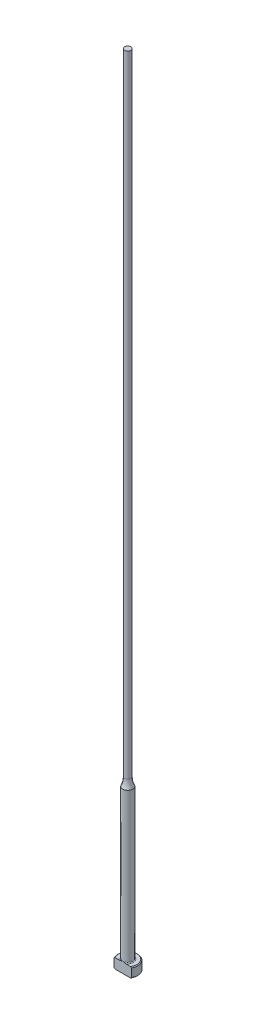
SolidWorks part; units mm, degrees
ref_plane "Front Plane" through (0, 0, 0) normal (0, 0, 1) x (1, 0, 0)
ref_plane "Top Plane" through (0, 0, 0) normal (0, 1, 0) x (1, 0, 0)
ref_plane "Right Plane" through (0, 0, 0) normal (1, 0, 0) x (0, 0, -1)
sketch "Sketch1" plane through (0, 0, 0) normal (0, 0, 1) x (1, 0, 0)
  line L0 (0, 259.9588) -> (0, -15.1925) construction
  line L1 (0, 0) -> (-3.175, 0)
  line L2 (-3.175, 0) -> (-3.175, 3.175)
  line L3 (-3.175, 3.175) -> (-1.5875, 3.175)
  line L4 (-0.9919, 53.4851) -> (-0.9919, 254)
  line L5 (-0.9919, 254) -> (0, 254)
  line L6 (0, 254) -> (0, 0)
  line L7 (-1.5875, 3.175) -> (-1.5875, 50.8)
  arc A0 (-1.5875, 50.8) -> (-0.9919, 53.4851) centre (-7.3419, 53.4851) ccw
  point P13 (-1.5875, 0)
  dimension "D1" = 6.35
  dimension "L" = 254
  dimension "D2" = 3.175
  dimension "H" = 6.35
  dimension "T" = 3.175
  dimension "D" = 1.9837
  dimension "S" = 50.8
revolve "Revolve1" add sketch "Sketch1" angle 360 about L0
chamfer "Chamfer1" distance 0.254 angle 45 2 edges at (0, 3.175, 3.175) (0, 0, 3.175)
fillet "Fillet1" radius 0.254 1 edges at (0, 3.175, 1.5875)
sketch "Sketch2" plane through (0, 0, 0) normal (0, -1, 0) x (1, 0, 0)
  line L0 (-2.7496, 1.5875) -> (2.7496, 1.5875)
  circle A0 centre (0, 0) radius 3.175 construction
  arc A1 (2.7496, 1.5875) -> (-2.7496, 1.5875) centre (0, 0) ccw
  circle A4 centre (0, 0) radius 1.5875 construction
  dimension "D1" = 0
extrude "KEY" cut sketch "Sketch2" against normal through all
